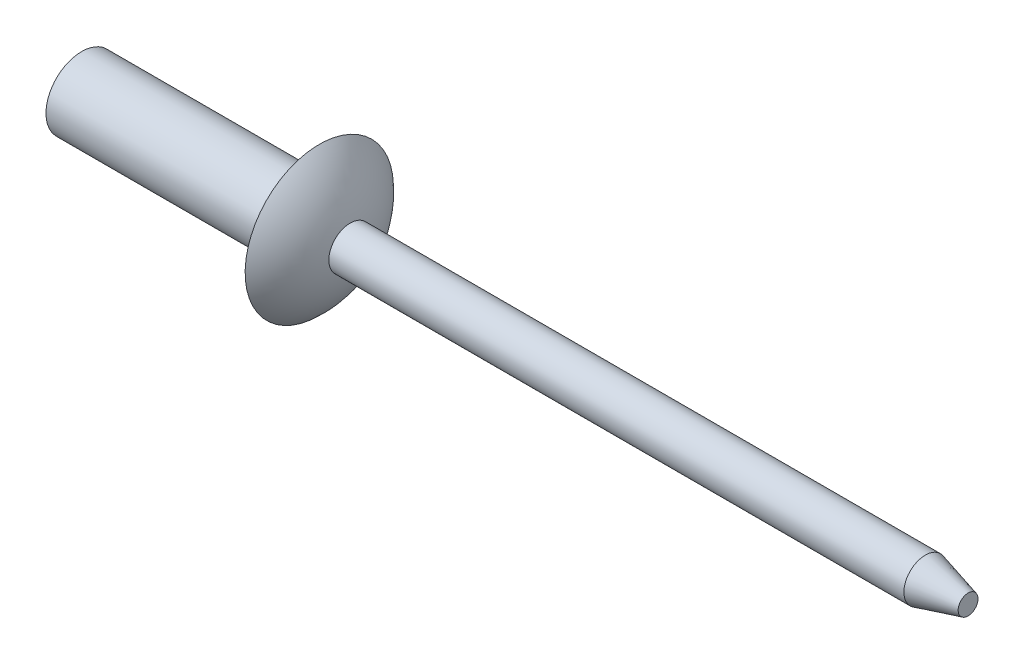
SolidWorks part; units mm, degrees
ref_plane "Front" through (0, 0, 0) normal (0, 0, 1) x (1, 0, 0)
ref_plane "Top" through (0, 0, 0) normal (0, 1, 0) x (1, 0, 0)
ref_plane "Right" through (0, 0, 0) normal (1, 0, 0) x (0, 0, -1)
sketch "Sketch1" plane through (-11.6035, 14.7235, 0) normal (0, 0, 1) x (0, -1, 0)
  line L0 (14.7235, 11.6035) -> (16.2235, 11.6035)
  line L1 (16.2235, 11.6035) -> (16.2235, 21.6035)
  line L2 (16.2235, 21.6035) -> (17.8435, 21.6035)
  line L3 (14.7235, 34.3377) -> (14.7235, -10.975) construction
  line L4 (15.6235, 22.9053) -> (15.6235, 48.9053)
  line L5 (15.6235, 48.9053) -> (14.7235, 48.9053)
  line L6 (14.7235, 11.6035) -> (14.7235, 48.9053)
  arc A0 (17.8435, 21.6035) -> (15.6235, 22.9053) centre (14.7235, 18.8269) ccw
  dimension "l" = 10
  dimension "d" = 3
  dimension "dk" = 6.24
  dimension "d1" = 1.8
  dimension "K" = 1.4
  dimension "l1" = 26
revolve "Base-Revolve" add sketch "Sketch1" angle 360 about L3
fillet "Fillet1" radius 0.5 1 edges at (10, 1.5, 0)
chamfer "Chamfer1" distance 1.8 angle 15 1 edges at (37.3019, 0.9, 0)
equation "\"D1@Chamfer1\" = \"d1@Sketch1\""
